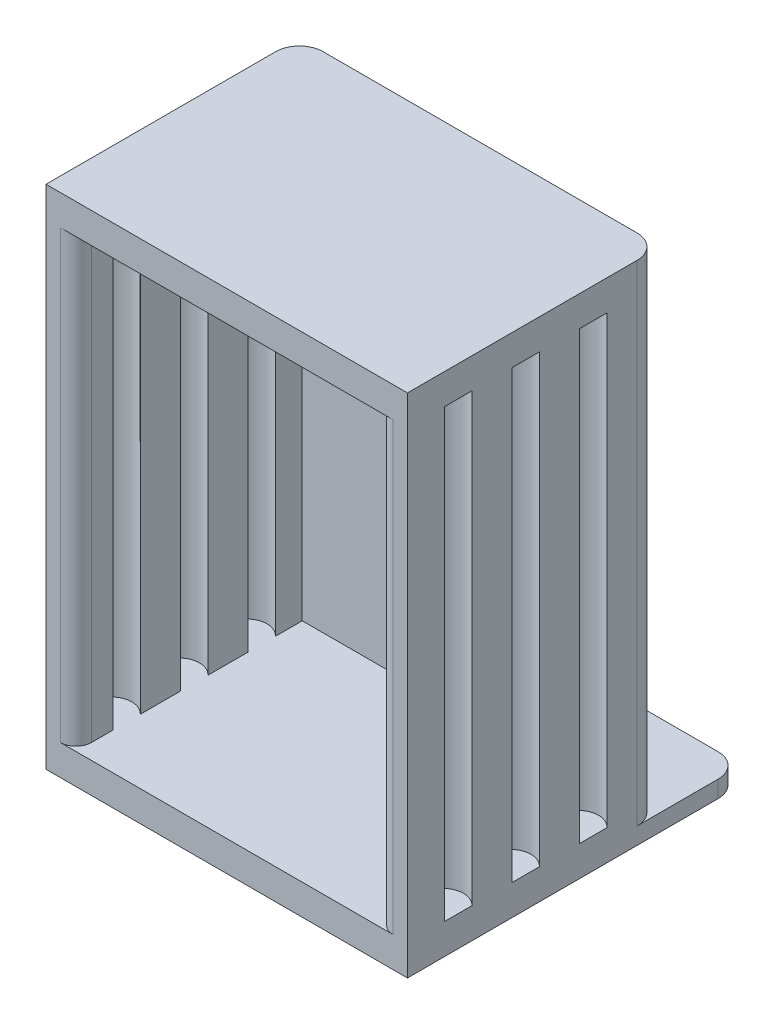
SolidWorks part; units mm, degrees
ref_plane "Front Plane" through (0, 0, 0) normal (0, 0, 1) x (1, 0, 0)
ref_plane "Top Plane" through (0, 0, 0) normal (0, 1, 0) x (1, 0, 0)
ref_plane "Right Plane" through (0, 0, 0) normal (1, 0, 0) x (0, 0, -1)
sketch "Sketch1" plane through (0, 0, 0) normal (0, 1, 0) x (1, 0, 0)
  line L0 (-55, 0) -> (55, 0) construction
  line L1 (-13.589, 0) -> (13.589, 0)
  line L2 (-13.589, 0) -> (-13.589, 19.05)
  line L3 (-13.589, 19.05) -> (13.589, 19.05)
  line L4 (13.589, 0) -> (13.589, 19.05)
  line L5 (0, -55) -> (0, 55) construction
  dimension "D1" = 27.178
  dimension "D2" = 13.589
  dimension "D3" = 19.05
extrude "Extrude1" add sketch "Sketch1" along normal blind 38.1
sketch "Sketch2" plane through (0, 0, 0) normal (0, 0, 1) x (1, 0, 0)
  line L0 (0, -55) -> (0, 55) construction
  line L1 (-11.3411, 2.286) -> (11.3411, 2.286)
  line L2 (-11.3411, 2.286) -> (-11.3411, 35.814)
  line L3 (-11.3411, 35.814) -> (11.3411, 35.814)
  line L4 (11.3411, 2.286) -> (11.3411, 35.814)
  line L5 (-13.589, 38.1) -> (13.589, 38.1) construction
  line L6 (55, 0) -> (-55, 0) construction
  dimension "D1" = 11.3411
  dimension "D2" = 22.6822
  dimension "D3" = 2.286
  dimension "D4" = 2.286
extrude "Cut-Extrude1" cut sketch "Sketch2" against normal blind 17.018
sketch "Sketch3" plane through (0, 0, 0) normal (0, -1, 0) x (1, 0, 0)
  line L0 (13.589, 0) -> (13.589, -19.05) construction
  line L1 (-13.589, -25.146) -> (13.589, -25.146)
  line L2 (-13.589, -25.146) -> (-13.589, -19.05)
  line L3 (-13.589, -19.05) -> (13.589, -19.05)
  line L4 (13.589, -25.146) -> (13.589, -19.05)
  line L5 (55, 0) -> (-55, 0) construction
  line L6 (-13.589, -19.05) -> (-13.589, 0) construction
  line L7 (13.589, -19.05) -> (-13.589, -19.05) construction
  dimension "D1" = 25.146
extrude "Extrude2" add sketch "Sketch3" against normal blind 1.27
fillet "Fillet1" radius 1.778 2 edges
ref_plane "Plane1" through (0, 19.05, 0) normal (0, 1, 0) x (-1, 0, 0)
sketch "Sketch4" plane through (0, 19.05, 0) normal (0, 1, 0) x (-1, 0, 0)
  line L0 (13.589, 0) -> (-13.589, 0) construction
  line L1 (0, 55) -> (0, -55) construction
  line L2 (-12.465, -3.81) -> (-12.465, -10.6386) construction
  circle A0 centre (-12.465, -3.81) radius 1.524
  circle A1 centre (-12.465, -8.89) radius 1.524
  circle A2 centre (-12.465, -13.97) radius 1.524
  dimension "D1" = 3.048
  dimension "D2" = 3.048
  dimension "D3" = 3.048
  dimension "D4" = 3.81
  dimension "D5" = 5.08
  dimension "D6" = 5.08
  dimension "D7" = 12.465
extrude "Cut-Extrude2" cut sketch "Sketch4" against normal mid plane 33.528
mirror "Mirror1" about plane through (0, 0, 0) normal (1, 0, 0) of "Cut-Extrude2"
fillet "Fillet2" radius 1.778 2 edges at (-13.589, 0.635, -25.146) (13.589, 0.635, -25.146)
fillet "Fillet3" radius 1.1684 2 edges at (11.3411, 19.05, 0) (-11.3411, 19.05, 0)
